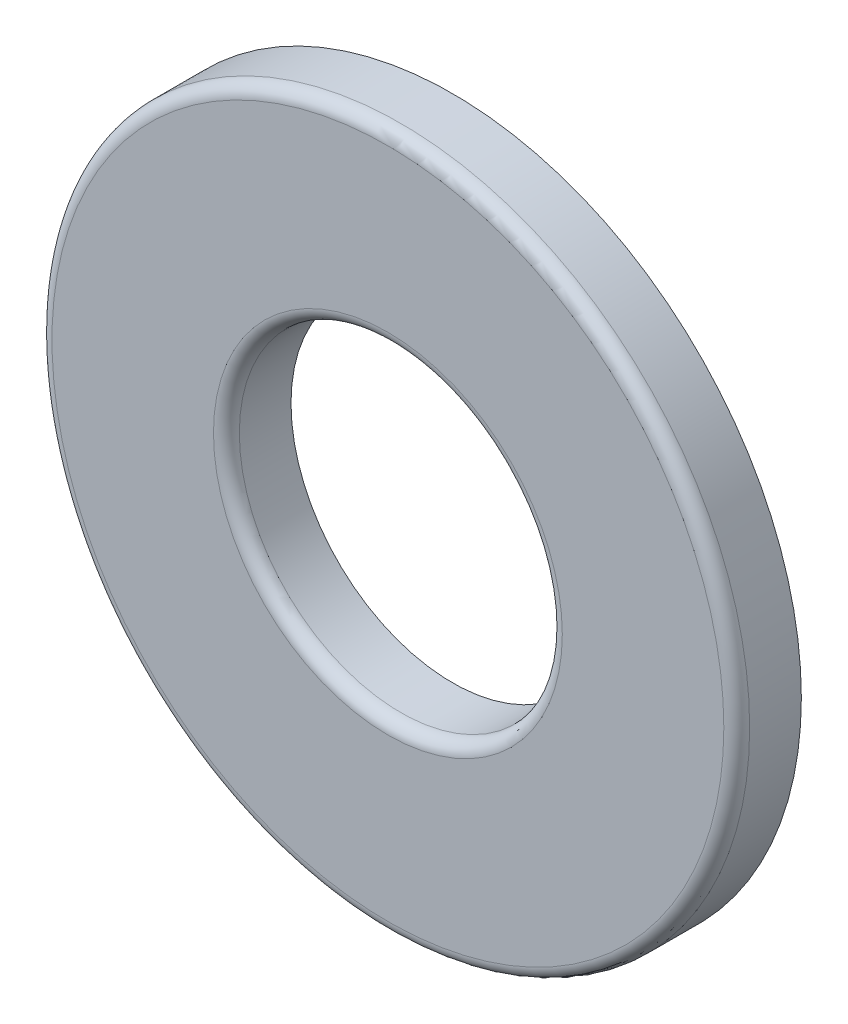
SolidWorks part; units mm, degrees
ref_plane "Plan1" through (0, 0, 0) normal (0, 0, 1) x (1, 0, 0)
ref_plane "Plan2" through (0, 0, 0) normal (0, 1, 0) x (1, 0, 0)
ref_plane "Plan3" through (0, 0, 0) normal (1, 0, 0) x (0, 0, -1)
sketch "Esquisse1" plane through (0, 0, 0) normal (0, 0, 1) x (1, 0, 0)
  circle A0 centre (0, 0) radius 6.25
  circle A1 centre (0, 0) radius 13.5
  dimension "D1" = 27
  dimension "D2" = 12.5
extrude "Base-Extrusion" add sketch "Esquisse1" along normal blind 2.5
fillet "Congé1" radius 0.5
